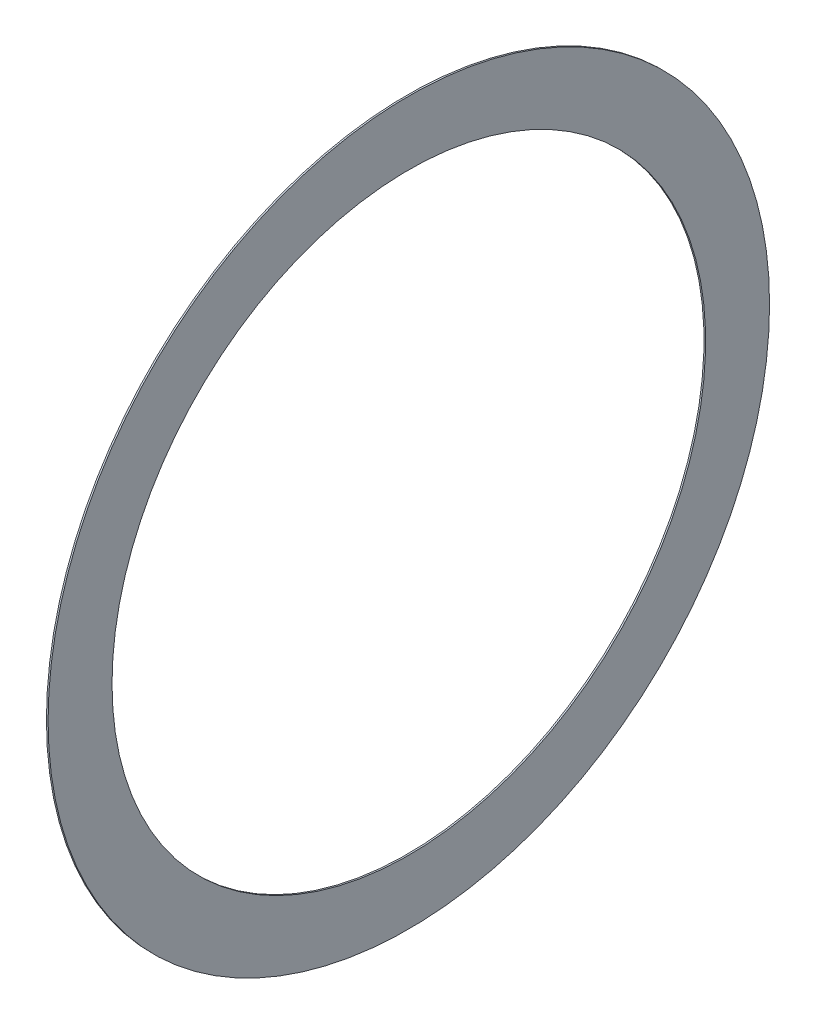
SolidWorks part; units mm, degrees
ref_plane "Face" through (0, 0, 0) normal (0, 0, 1) x (1, 0, 0)
ref_plane "Dessus" through (0, 0, 0) normal (0, 1, 0) x (1, 0, 0)
ref_plane "Droite" through (0, 0, 0) normal (1, 0, 0) x (0, 0, -1)
sketch "Esquisse1" plane through (0, 0, 0) normal (0, 0, 1) x (1, 0, 0)
  line L0 (0, 0) -> (81.871, 0) construction
  line L1 (0, 55) -> (0.25, 55)
  line L2 (0, 55) -> (0, 45.25)
  line L3 (0, 45.25) -> (0.25, 45.25)
  line L4 (0.25, 55) -> (0.25, 45.25)
  dimension "D1" = 55
  dimension "D2" = 45.25
  dimension "D3" = 0.25
revolve "Révolution1" add sketch "Esquisse1" angle 360 about L0
